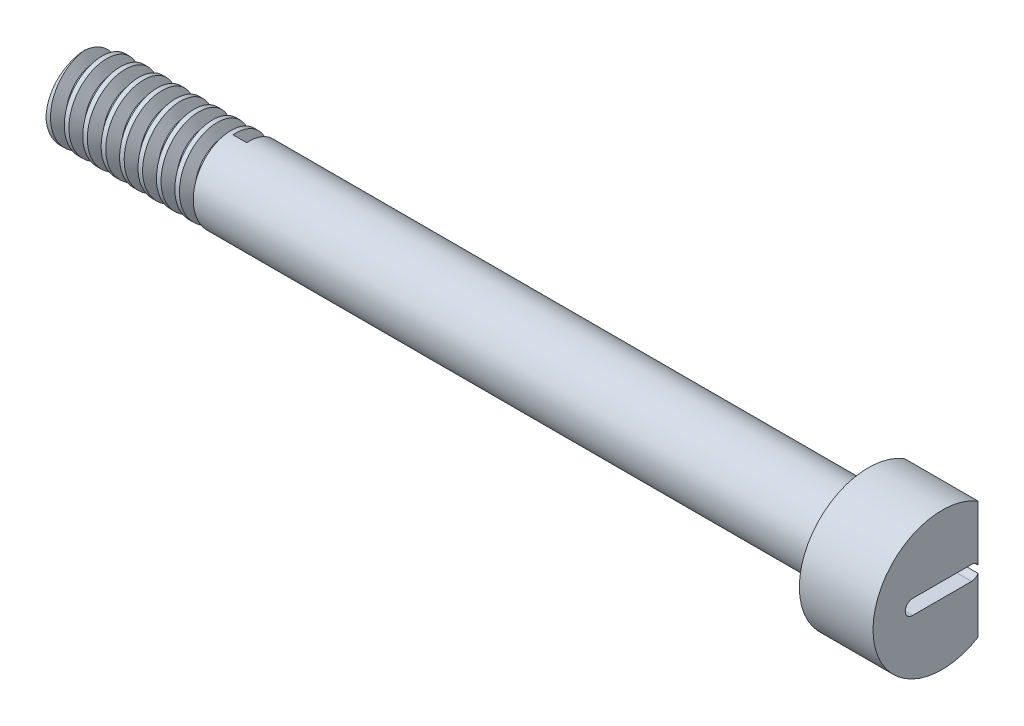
SolidWorks part; units mm, degrees
ref_plane "Front Plane" through (0, 0, 0) normal (0, 0, 1) x (1, 0, 0)
ref_plane "Top Plane" through (0, 0, 0) normal (0, 1, 0) x (1, 0, 0)
ref_plane "Right Plane" through (0, 0, 0) normal (1, 0, 0) x (0, 0, -1)
sketch "Sketch1" plane through (0, 0, 0) normal (0, 0, 1) x (1, 0, 0)
  line L0 (-6.35, 2.4765) -> (6.35, 2.4765) construction
  line L1 (-6.35, 0) -> (0, 0) construction
  line L2 (-6.35, -0.254) -> (-6.35, 0) construction
  line L3 (-6.35, 0) -> (-6.35, 2.4765) construction
  line L4 (0, 0) -> (0, 2.4765) construction
  circle A0 centre (-6.35, 2.4765) radius 2.7305
  circle A1 centre (6.35, 2.4765) radius 2.7305
  dimension "D1" = 5.461
  dimension "D2" = 12.7
  dimension "D3" = 0.254
extrude "Boss-Extrude1" add sketch "Sketch1" along normal blind 53.975
sketch "Sketch2" plane through (0, 0, 53.975) normal (0, 0, 1) x (1, 0, 0)
  circle A0 centre (-6.35, 2.4765) radius 4.7625
  circle A1 centre (6.35, 2.4765) radius 4.7625
  dimension "D1" = 9.525
extrude "Boss-Extrude2" add sketch "Sketch2" along normal blind 5.08
sketch "Sketch3" plane through (0, 0, 59.055) normal (0, 0, 1) x (1, 0, 0)
  line L0 (-6.35, 0.4445) -> (-6.35, 4.5085) construction
  line L3 (-6.858, 0.4445) -> (-6.858, 4.5085)
  line L6 (-5.842, 0.4445) -> (-5.842, 4.5085)
  line L7 (6.35, 0.4445) -> (6.35, 4.5085) construction
  line L8 (5.842, 0.4445) -> (5.842, 4.5085)
  line L9 (6.858, 0.4445) -> (6.858, 4.5085)
  circle A5 centre (6.35, 2.4765) radius 4.7625 construction
  circle A6 centre (-6.35, 2.4765) radius 4.7625 construction
  circle A7 centre (6.35, 2.4765) radius 4.7625 construction
  circle A8 centre (-6.35, 2.4765) radius 4.7625 construction
  arc A9 (-6.858, 0.4445) -> (-5.842, 0.4445) centre (-6.35, 0.4445) ccw
  arc A10 (-5.842, 4.5085) -> (-6.858, 4.5085) centre (-6.35, 4.5085) ccw
  arc A11 (5.842, 0.4445) -> (6.858, 0.4445) centre (6.35, 0.4445) ccw
  arc A12 (6.858, 4.5085) -> (5.842, 4.5085) centre (6.35, 4.5085) ccw
  point P7 (-6.35, 2.4765)
  point P13 (6.35, 2.4765)
  dimension "D1" = 4.064
  dimension "D2" = 1.016
  dimension "D3" = 1.016
extrude "Cut-Extrude1" cut sketch "Sketch3" against normal blind 3.81
thread "Thread1" pitch 1.27 start angle 0, offset 1.27, length 11.43, pitch 1.27, diameter 5.461
ref_plane "Plane1" through (9.0805, 2.4765, -1.27) normal (0, 1, 0) x (-1, 0, 0)
sketch "Thread Profile1" plane through (9.0805, 2.4765, -1.27) normal (0, 1, 0) x (-1, 0, 0)
  line L0 (0, 0) -> (0, 1.27) construction
  line L1 (0, 0) -> (0.6874, 0.3969)
  line L2 (0.6874, 0.3969) -> (0.6874, 0.5556)
  line L3 (0.6874, 0.5556) -> (0, 0.9525)
  line L4 (0.6874, 0.4762) -> (0, 0.4762) construction
  line L11 (0, 0) -> (0, 0.9525)
  point P2 (0, 0)
  dimension "Pitch" = 1.27
  dimension "Profile_Angle" = 60
  dimension "Profile_Land" = 0.1588
  dimension "Profile_Height" = 0.6874
thread "Thread2" pitch 1.27 start angle 0, offset 1.27, length 11.43, pitch 1.27, diameter 5.461
ref_plane "Plane2" through (-3.6195, 2.4765, -1.27) normal (0, 1, 0) x (-1, 0, 0)
sketch "Thread Profile2" plane through (-3.6195, 2.4765, -1.27) normal (0, 1, 0) x (-1, 0, 0)
  line L0 (0, 0) -> (0, 1.27) construction
  line L1 (0, 0) -> (0.6874, 0.3969)
  line L2 (0.6874, 0.3969) -> (0.6874, 0.5556)
  line L3 (0.6874, 0.5556) -> (0, 0.9525)
  line L4 (0.6874, 0.4762) -> (0, 0.4762) construction
  line L11 (0, 0) -> (0, 0.9525)
  point P2 (0, 0)
  dimension "Pitch" = 1.27
  dimension "Profile_Angle" = 60
  dimension "Profile_Land" = 0.1588
  dimension "Profile_Height" = 0.6874
sketch "Sketch9" plane through (0, 0, 0) normal (0, 1, 0) x (1, 0, 0)
  line L0 (-11.1125, -59.055) -> (-1.5875, -59.055) construction
  line L2 (1.5875, -59.055) -> (11.1125, -59.055) construction
  line L3 (6.35, -59.055) -> (6.35, -68.58) construction
  line L4 (-6.35, -59.055) -> (-6.35, -68.58) construction
  circle A0 centre (-6.35, -68.58) radius 4.699
  circle A1 centre (6.35, -68.58) radius 4.699
  circle A2 centre (-6.35, -68.58) radius 2.921
  circle A3 centre (6.35, -68.58) radius 2.921
  dimension "D2" = 9.398
  dimension "D3" = 5.842
  dimension "D1" = 9.525
extrude "Boss-Extrude3" add sketch "Sketch9" along normal blind 3.81 separate body
sketch "Sketch11" plane through (0, 3.81, 0) normal (0, 1, 0) x (1, 0, 0)
  line L0 (-6.35, -69.215) -> (-6.35, -67.945) construction
  line L1 (-10.414, -69.215) -> (-10.414, -67.945)
  line L2 (-2.286, -69.215) -> (-2.286, -67.945)
  line L3 (6.35, -69.215) -> (6.35, -67.945) construction
  line L4 (2.286, -69.215) -> (2.286, -67.945)
  line L5 (10.414, -69.215) -> (10.414, -67.945)
  circle A0 centre (6.35, -68.58) radius 4.699 construction
  circle A1 centre (-6.35, -68.58) radius 4.699 construction
  circle A2 centre (6.35, -68.58) radius 4.699 construction
  circle A3 centre (-6.35, -68.58) radius 4.699 construction
  arc A4 (-10.414, -69.215) -> (-2.286, -69.215) centre (-6.35, -69.215) ccw
  arc A5 (-2.286, -67.945) -> (-10.414, -67.945) centre (-6.35, -67.945) ccw
  arc A6 (2.286, -69.215) -> (10.414, -69.215) centre (6.35, -69.215) ccw
  arc A7 (10.414, -67.945) -> (2.286, -67.945) centre (6.35, -67.945) ccw
  circle A8 centre (-6.35, -68.58) radius 2.921
  circle A9 centre (6.35, -68.58) radius 2.921
  circle A10 centre (6.35, -68.58) radius 2.921 construction
  circle A11 centre (-6.35, -68.58) radius 2.921 construction
  point P8 (-6.35, -68.58)
  point P13 (6.35, -68.58)
  dimension "D1" = 8.128
  dimension "D2" = 8.128
extrude "Boss-Extrude4" add sketch "Sketch11" along normal blind 1.3716
chamfer "Chamfer1" distance 0.9398 angle 35 4 edges at (-6.35, 5.1816, 63.881) (-10.414, 5.1816, 68.58) (-2.286, 5.1816, 68.58) (-6.35, 5.1816, 73.279)
sketch "Sketch12" plane through (0, 5.1816, 0) normal (0, 1, 0) x (1, 0, 0)
  line L2 (-2.9441, -69.215) -> (-2.9441, -67.945)
  line L3 (-9.7559, -67.945) -> (-9.7559, -69.215)
  line L4 (-2.9441, -69.215) -> (-2.9441, -67.945)
  line L5 (-9.7559, -67.945) -> (-9.7559, -69.215)
  circle A0 centre (-6.35, -68.58) radius 2.921 construction
  circle A1 centre (-6.35, -68.58) radius 2.921
  arc A2 (-2.9441, -67.945) -> (-9.7559, -67.945) centre (-6.35, -67.945) ccw
  arc A3 (-9.7559, -69.215) -> (-2.9441, -69.215) centre (-6.35, -69.215) ccw
  arc A4 (-2.9441, -67.945) -> (-9.7559, -67.945) centre (-6.35, -67.945) ccw
  arc A5 (-9.7559, -69.215) -> (-2.9441, -69.215) centre (-6.35, -69.215) ccw
  dimension "D1" = 0
extrude "Boss-Extrude5" add sketch "Sketch12" along normal blind 0.6604
chamfer "Chamfer2" distance 0.9398 angle 35 4 edges at (6.35, 5.1816, 63.881) (2.286, 5.1816, 68.58) (10.414, 5.1816, 68.58) (6.35, 5.1816, 73.279)
sketch "Sketch13" plane through (0, 5.1816, 0) normal (0, 1, 0) x (1, 0, 0)
  line L2 (9.7559, -69.215) -> (9.7559, -67.945)
  line L3 (2.9441, -67.945) -> (2.9441, -69.215)
  line L4 (9.7559, -69.215) -> (9.7559, -67.945)
  line L5 (2.9441, -67.945) -> (2.9441, -69.215)
  circle A1 centre (6.35, -68.58) radius 2.921
  circle A2 centre (6.35, -68.58) radius 2.921
  arc A4 (9.7559, -67.945) -> (2.9441, -67.945) centre (6.35, -67.945) ccw
  arc A5 (2.9441, -69.215) -> (9.7559, -69.215) centre (6.35, -69.215) ccw
  arc A6 (9.7559, -67.945) -> (2.9441, -67.945) centre (6.35, -67.945) ccw
  arc A7 (2.9441, -69.215) -> (9.7559, -69.215) centre (6.35, -69.215) ccw
  dimension "D1" = 0
  dimension "D2" = 0
extrude "Boss-Extrude6" add sketch "Sketch13" along normal blind 0.6604
thread "Thread3" pitch 1.0583 start angle 0, offset 0, length 6.35, pitch 1.27, diameter 5.842
ref_plane "Plane3" through (-9.271, 5.842, 68.58) normal (0, 0, 1) x (-1, 0, 0)
sketch "Thread Profile3" plane through (-9.271, 5.842, 68.58) normal (0, 0, 1) x (-1, 0, 0)
  line L0 (0, 0) -> (0, 1.0583) construction
  line L11 (0, 0) -> (0, 0.926)
  line L12 (0, 0.926) -> (-0.5728, 0.5953)
  line L13 (-0.5728, 0.5953) -> (-0.5728, 0.3307)
  line L15 (-0.5728, 0.3307) -> (0, 0)
  line L17 (-0.5728, 0.463) -> (0, 0.463) construction
  point P2 (0, 0)
  dimension "Pitch" = 1.0583
  dimension "Profile_Angle" = 60
  dimension "Profile_Land" = 0.2646
  dimension "Profile_Height" = 0.5728
thread "Thread4" pitch 1.0583 start angle 0, offset 0, length 6.35, pitch 1.27, diameter 5.842
ref_plane "Plane4" through (3.429, 5.842, 68.58) normal (0, 0, 1) x (-1, 0, 0)
sketch "Thread Profile4" plane through (3.429, 5.842, 68.58) normal (0, 0, 1) x (-1, 0, 0)
  line L0 (0, 0) -> (0, 1.0583) construction
  line L11 (0, 0) -> (0, 0.926)
  line L12 (0, 0.926) -> (-0.5728, 0.5953)
  line L13 (-0.5728, 0.5953) -> (-0.5728, 0.3307)
  line L15 (-0.5728, 0.3307) -> (0, 0)
  line L17 (-0.5728, 0.463) -> (0, 0.463) construction
  point P2 (0, 0)
  dimension "Pitch" = 1.0583
  dimension "Profile_Angle" = 60
  dimension "Profile_Land" = 0.2646
  dimension "Profile_Height" = 0.5728
sketch "Sketch8" plane through (0, 0, 0) normal (0, 0, 1) x (1, 0, 0)
  line L1 (-12.7, 0) -> (12.7, 0)
  line L2 (-12.7, 0) -> (-12.7, -3.81)
  line L3 (-12.7, -3.81) -> (12.7, -3.81)
  line L4 (12.7, 0) -> (12.7, -3.81)
  point P9 (0, 0)
  dimension "D1" = 3.81
  dimension "D2" = 25.4
extrude "Cut-Extrude2" cut sketch "Sketch8" against normal through all both and the other way through all
sketch "Sketch14" plane through (0, 0, 0) normal (0, 1, 0) x (1, 0, 0)
  line L0 (-6.35, -59.055) -> (-6.35, 0) construction
  line L1 (-12.7, -73.9775) -> (0, -73.9775)
  line L2 (-12.7, -73.9775) -> (-12.7, 14.9225)
  line L3 (-12.7, 14.9225) -> (0, 14.9225)
  line L4 (0, -73.9775) -> (0, 14.9225)
  line L5 (-12.7, -73.9775) -> (0, 14.9225) construction
  line L6 (-12.7, 14.9225) -> (0, -73.9775) construction
  line L7 (-11.1125, -59.055) -> (-1.5875, -59.055) construction
  point P0 (-6.35, -29.5275)
  dimension "D1" = 88.9
  dimension "D2" = 12.7
extrude "Cut-Extrude3" cut sketch "Sketch14" against normal through all both and the other way through all
sketch "Sketch15" plane through (0, 0, 0) normal (0, -1, 0) x (1, 0, 0)
  circle A0 centre (6.35, 68.58) radius 6.35
  dimension "D1" = 12.7
extrude "Cut-Extrude4" cut sketch "Sketch15" against normal through all both and the other way through all
move or copy body "Body-Move/Copy1" bodies to move or copy 109 copy no rotation origin (-6.6962, -9.5537, 16.2498) rotation axis (0.5774, 0.5774, 0.5774) rotation angle 120
